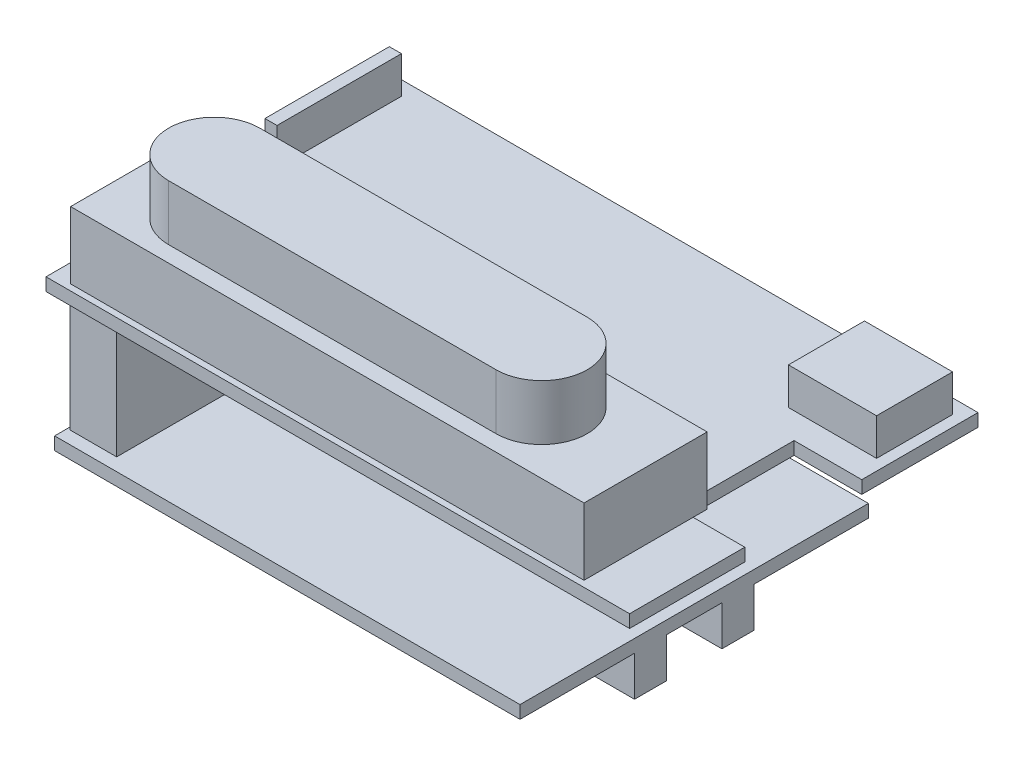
SolidWorks part; units mm, degrees
ref_plane "Front Plane" through (0, 0, 0) normal (0, 0, 1) x (1, 0, 0)
ref_plane "Top Plane" through (0, 0, 0) normal (0, 1, 0) x (1, 0, 0)
ref_plane "Right Plane" through (0, 0, 0) normal (1, 0, 0) x (0, 0, -1)
sketch "Sketch1" plane through (0, 0, 0) normal (0, 1, 0) x (1, 0, 0)
  line L0 (60.198, 23.9522) -> (53.213, 23.9522)
  line L1 (0, 0) -> (60.198, 0)
  line L2 (0, 0) -> (0, 35.941)
  line L3 (0, 35.941) -> (60.198, 35.941)
  line L4 (60.198, 0) -> (60.198, 11.8872)
  line L5 (53.213, 23.9522) -> (53.213, 11.8872)
  line L6 (53.213, 11.8872) -> (60.198, 11.8872)
  line L7 (60.198, 23.9522) -> (60.198, 35.941)
  dimension "D1" = 35.941
  dimension "D2" = 60.198
  dimension "D3" = 12.065
  dimension "D4" = 11.8872
  dimension "D5" = 6.985
extrude "Extrude1" add sketch "Sketch1" along normal blind 1.3208
sketch "Sketch2" plane through (0, 1.3208, 0) normal (0, 1, 0) x (1, 0, 0)
  line L0 (0, 0) -> (60.198, 0) construction
  line L1 (1.905, 0.635) -> (54.864, 0.635)
  line L2 (1.905, 0.635) -> (1.905, 13.335)
  line L3 (1.905, 13.335) -> (54.864, 13.335)
  line L4 (54.864, 0.635) -> (54.864, 13.335)
  line L5 (0, 35.941) -> (0, 0) construction
  dimension "D1" = 12.7
  dimension "D2" = 52.959
  dimension "D3" = 0.635
  dimension "D4" = 1.905
extrude "Extrude2" add sketch "Sketch2" along normal blind 6.9088
sketch "Sketch3" plane through (0, 8.2296, 0) normal (0, 1, 0) x (1, 0, 0)
  line L0 (44.1445, 6.985) -> (54.864, 6.985) construction
  line L1 (54.864, 0.635) -> (54.864, 13.335) construction
  line L2 (10.3625, 6.985) -> (1.905, 6.985) construction
  line L4 (1.905, 13.335) -> (1.905, 0.635) construction
  line L6 (10.3625, 11.684) -> (44.1445, 11.684)
  line L7 (44.1445, 2.286) -> (10.3625, 2.286)
  arc A0 (10.3625, 11.684) -> (10.3625, 2.286) centre (10.3625, 6.985) ccw
  arc A1 (44.1445, 2.286) -> (44.1445, 11.684) centre (44.1445, 6.985) ccw
  point P8 (48.8435, 6.985)
  point P9 (5.6635, 6.985)
  dimension "D1" = 43.18
  dimension "D2" = 9.398
extrude "Extrude3" add sketch "Sketch3" along normal blind 5.715
sketch "Sketch4" plane through (0, 1.3208, 0) normal (0, 1, 0) x (1, 0, 0)
  line L1 (59.0605, 34.4563) -> (49.971, 34.4563)
  line L2 (59.0605, 34.4563) -> (59.0605, 26.6144)
  line L3 (59.0605, 26.6144) -> (49.971, 26.6144)
  line L4 (49.971, 34.4563) -> (49.971, 26.6144)
  line L5 (0.9593, 34.4563) -> (2.2068, 34.4563)
  line L6 (0.9593, 34.4563) -> (0.9593, 21.6241)
  line L7 (0.9593, 21.6241) -> (2.2068, 21.6241)
  line L8 (2.2068, 34.4563) -> (2.2068, 21.6241)
extrude "Extrude4" add sketch "Sketch4" along normal blind 3.81
sketch "Sketch5" plane through (0, 0, 0) normal (0, -1, 0) x (1, 0, 0)
  line L0 (0, 0) -> (60.198, 0) construction
  line L1 (1.143, -1.3208) -> (5.969, -1.3208)
  line L2 (1.143, -1.3208) -> (1.143, -18.8468)
  line L3 (1.143, -18.8468) -> (5.969, -18.8468)
  line L4 (5.969, -1.3208) -> (5.969, -18.8468)
  line L5 (0, -35.941) -> (0, 0) construction
  dimension "D1" = 17.526
  dimension "D2" = 4.826
  dimension "D3" = 1.3208
  dimension "D4" = 1.143
extrude "Extrude5" add sketch "Sketch5" along normal blind 12.446
sketch "Sketch6" plane through (0, -12.446, 0) normal (0, -1, 0) x (1, 0, 0)
  line L0 (60.198, -35.941) -> (0, -35.941) construction
  line L1 (0.889, 0) -> (48.895, 0)
  line L2 (0.889, 0) -> (0.889, -21.336)
  line L3 (0.889, -35.941) -> (48.895, -35.941)
  line L4 (48.895, 0) -> (48.895, -35.941)
  line L5 (0, 0) -> (60.198, 0) construction
  line L6 (1.143, -1.3208) -> (1.143, -18.8468) construction
  line L7 (6.604, -21.336) -> (0.889, -21.336)
  line L8 (6.604, -24.765) -> (0.889, -24.765)
  line L9 (0.889, -24.765) -> (0.889, -35.941)
  arc A0 (6.604, -24.765) -> (6.604, -21.336) centre (6.604, -23.0505) ccw
  dimension "D1" = 0.254
  dimension "D2" = 48.006
  dimension "D3" = 5.715
  dimension "D4" = 3.429
  dimension "D5" = 21.336
extrude "Extrude6" add sketch "Sketch6" along normal blind 1.3208
sketch "Sketch7" plane through (0, -13.7668, 0) normal (0, -1, 0) x (1, 0, 0)
  line L0 (48.895, -35.941) -> (48.895, 0) construction
  line L1 (48.895, -15.113) -> (33.1978, -15.113)
  line L2 (48.895, -15.113) -> (48.895, -11.811)
  line L3 (48.895, -11.811) -> (33.1978, -11.811)
  line L4 (33.1978, -15.113) -> (33.1978, -11.811)
  line L5 (48.895, -24.13) -> (33.1978, -24.13)
  line L6 (48.895, -24.13) -> (48.895, -20.828)
  line L7 (48.895, -20.828) -> (33.1978, -20.828)
  line L8 (33.1978, -24.13) -> (33.1978, -20.828)
  line L9 (41.0464, -11.811) -> (41.0464, 0) construction
  line L10 (48.895, 0) -> (0.889, 0) construction
  line L11 (41.0464, -24.13) -> (41.0464, -35.941) construction
  line L12 (0.889, -35.941) -> (48.895, -35.941) construction
  dimension "D1" = 15.6972
  dimension "D2" = 3.302
  dimension "D3" = 5.715
extrude "Extrude7" add sketch "Sketch7" along normal blind 4.1148
